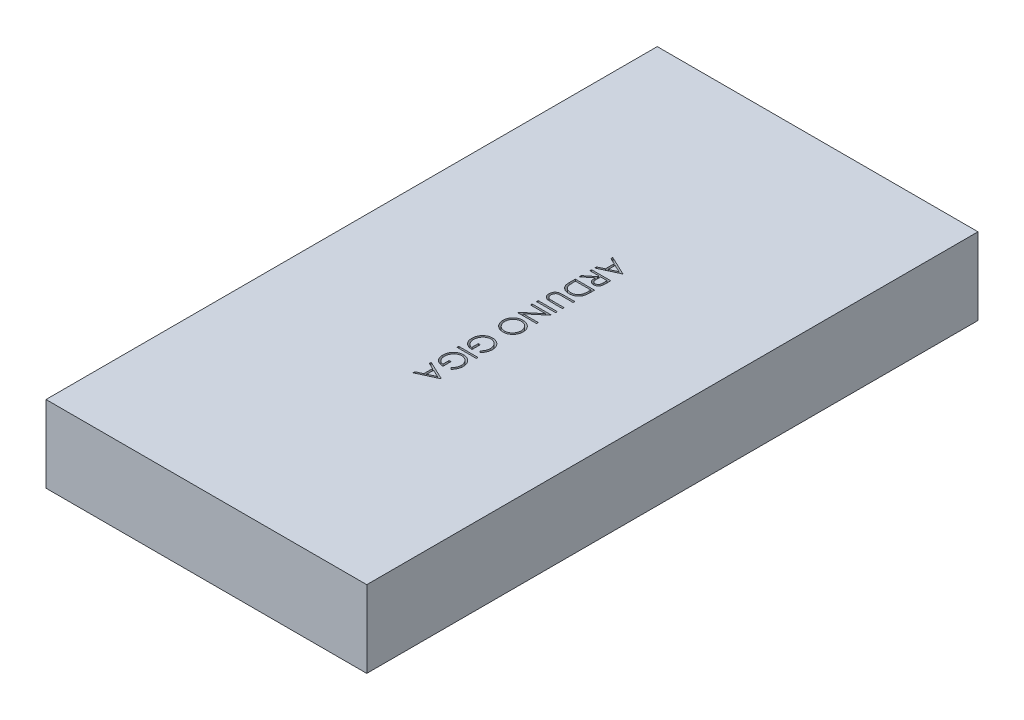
SolidWorks part; units mm, degrees
ref_plane "Front Plane" through (0, 0, 0) normal (0, 0, 1) x (1, 0, 0)
ref_plane "Top Plane" through (0, 0, 0) normal (0, 1, 0) x (1, 0, 0)
ref_plane "Right Plane" through (0, 0, 0) normal (1, 0, 0) x (0, 0, -1)
sketch "Sketch1" plane through (0, 0, 0) normal (0, 1, 0) x (1, 0, 0)
  line L1 (0, 0) -> (53, 0)
  line L2 (0, 0) -> (0, 101)
  line L3 (0, 101) -> (53, 101)
  line L4 (53, 0) -> (53, 101)
  dimension "D1" = 101
  dimension "D2" = 53
extrude "Boss-Extrude1" add sketch "Sketch1" along normal blind 12.7
sketch "Sketch2" plane through (0, 12.7, 0) normal (0, 1, 0) x (1, 0, 0)
  line L0 (26.5, 101) -> (26.5, 0) construction
  line L1 (53, 101) -> (0, 101) construction
  line L2 (0, 0) -> (53, 0) construction
  text T0 "ARDUINO GIGA"
extrude "Cut-Extrude1" cut sketch "Sketch2" against normal blind 6.35
